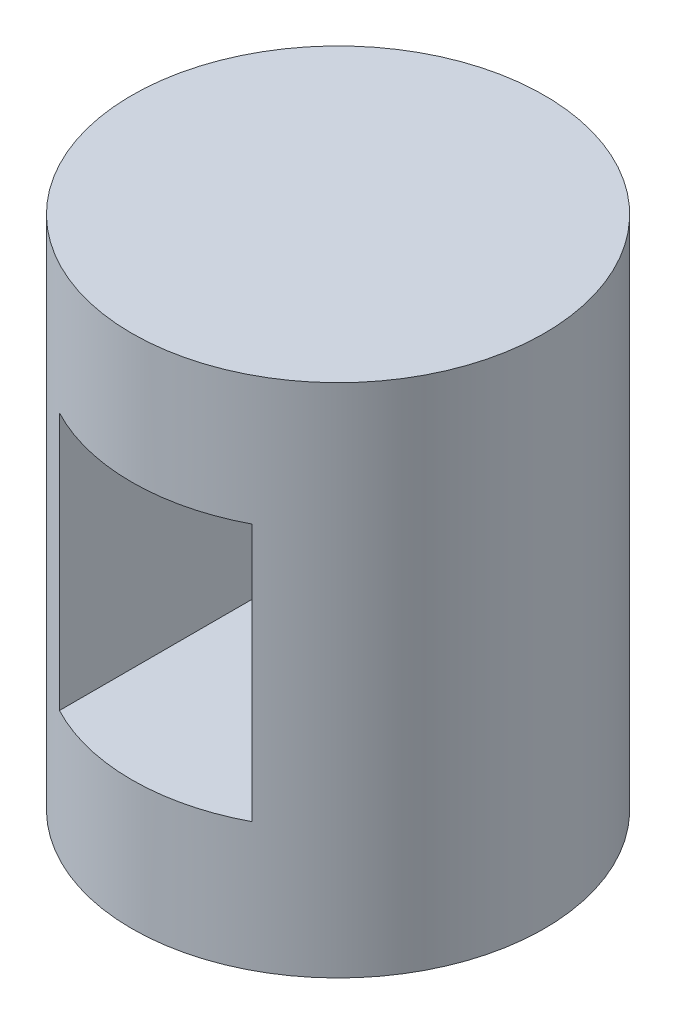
SolidWorks part; units mm, degrees
ref_plane "前视基准面" through (0, 0, 0) normal (0, 0, 1) x (1, 0, 0)
ref_plane "上视基准面" through (0, 0, 0) normal (0, 1, 0) x (1, 0, 0)
ref_plane "右视基准面" through (0, 0, 0) normal (1, 0, 0) x (0, 0, -1)
sketch "草图1" plane through (0, 0, 0) normal (0, 1, 0) x (1, 0, 0)
  circle A0 centre (0, 0) radius 30
  dimension "D1" = 60
extrude "拉伸1" add sketch "草图1" along normal blind 75
sketch "草图4" plane through (0, 0, 0) normal (0, 0, 1) x (1, 0, 0)
  line L0 (0, 0) -> (0, 80.0847) construction
  line L1 (-14, 56.25) -> (14, 56.25)
  line L2 (-14, 56.25) -> (-14, 18.75)
  line L3 (-14, 18.75) -> (14, 18.75)
  line L4 (14, 56.25) -> (14, 18.75)
  line L6 (30, 75) -> (-30, 75) construction
  dimension "D1" = 37.5
  dimension "D2" = 18.75
  dimension "D3" = 28
extrude "切除-拉伸3" cut sketch "草图4" against normal mid plane 60
